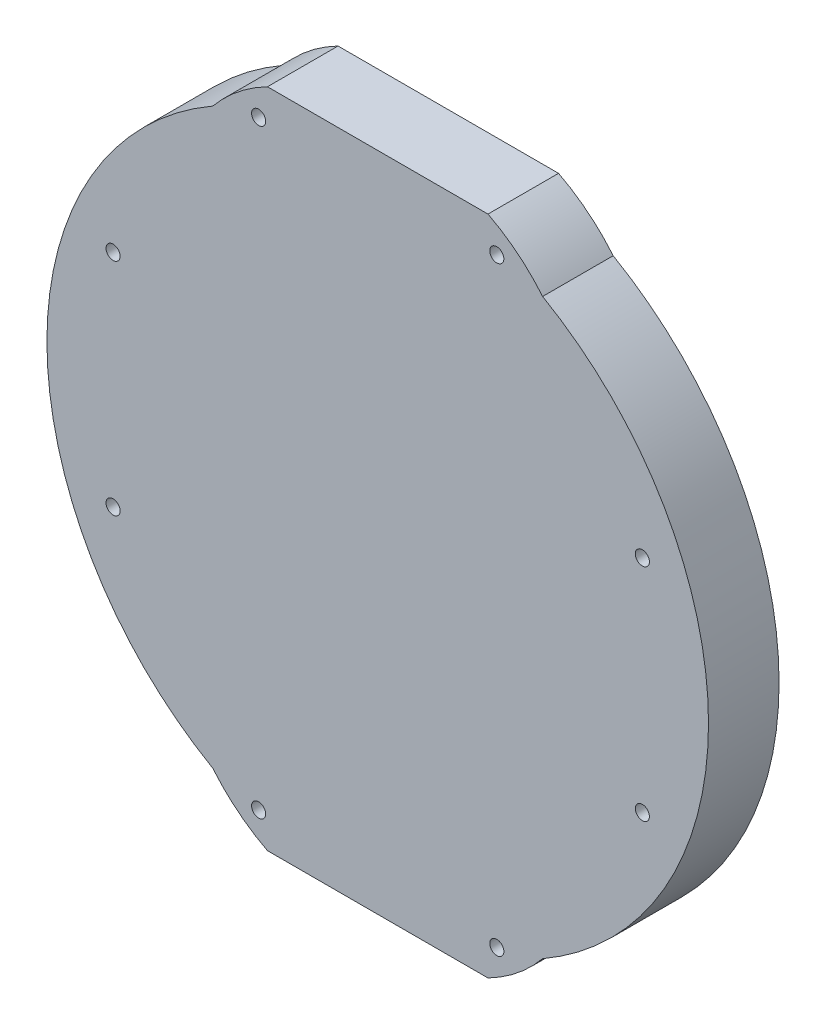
SolidWorks part; units mm, degrees
ref_plane "前视基准面" through (0, 0, 0) normal (0, 0, 1) x (1, 0, 0)
ref_plane "上视基准面" through (0, 0, 0) normal (0, 1, 0) x (1, 0, 0)
ref_plane "右视基准面" through (0, 0, 0) normal (1, 0, 0) x (0, 0, -1)
sketch "草图1" plane through (0, 0, 0) normal (0, 0, 1) x (1, 0, 0)
  line L0 (0, 0) -> (38.4208, 0) construction
  line L1 (-75, -75) -> (75, -75)
  line L2 (-75, -75) -> (-75, 75)
  line L3 (-75, 75) -> (75, 75)
  line L4 (75, -75) -> (75, 75)
  line L5 (-75, -75) -> (75, 75) construction
  line L6 (-75, 75) -> (75, -75) construction
  line L7 (0, 0) -> (0, 33.6244) construction
  line L8 (-25, 75) -> (25, 75)
  circle A0 centre (0, 0) radius 75
  circle A1 centre (-27, 68) radius 1.6
  circle A2 centre (-60, 25) radius 1.6
  circle A3 centre (60, 25) radius 1.6
  circle A4 centre (27, 68) radius 1.6
  circle A5 centre (27, -68) radius 1.6
  circle A6 centre (60, -25) radius 1.6
  circle A7 centre (-60, -25) radius 1.6
  circle A8 centre (-27, -68) radius 1.6
  arc A9 (-25, 75) -> (-37.3911, 65.0147) centre (-6.885, 39.8396) ccw
  arc A10 (25, 75) -> (37.3911, 65.0147) centre (6.885, 39.8396) cw
  arc A11 (25, -75) -> (37.3911, -65.0147) centre (6.885, -39.8396) ccw
  arc A12 (-25, -75) -> (-37.3911, -65.0147) centre (-6.885, -39.8396) cw
  point P0 (0, 0)
  dimension "D1" = 150
  dimension "D4" = 27
  dimension "D5" = 68
  dimension "D6" = 3.2
  dimension "D7" = 60
  dimension "D8" = 25
  dimension "D9" = 3.2
  dimension "D2" = 150
  dimension "D3" = 150
  dimension "D10" = 50
  dimension "D11" = 25
extrude "凸台-拉伸1" add sketch "草图1" along normal blind 16 contours A0 A7 A6 A5 A3 A2 A1 A4 A8 | L3 A9 A0 | A10 L8 A0 | A12 L1 A0 | L1 A11 A0
